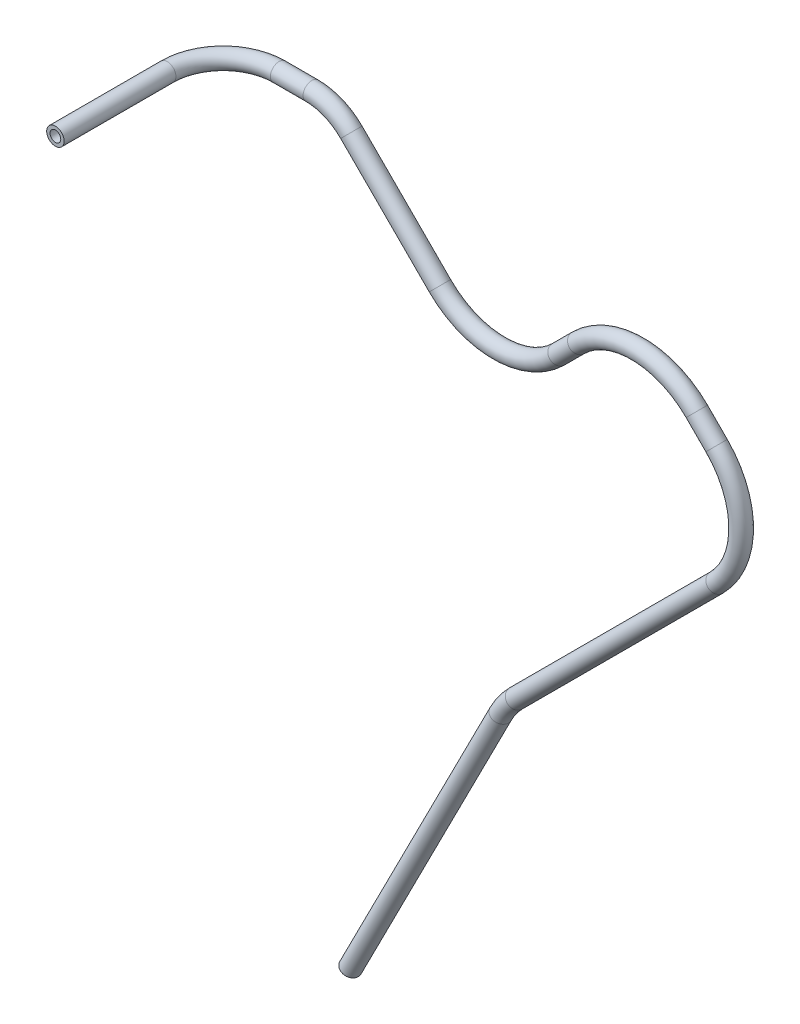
SolidWorks part; units mm, degrees
ref_plane "Front" through (0, 0, 0) normal (0, 0, 1) x (1, 0, 0)
ref_plane "Top" through (0, 0, 0) normal (0, 1, 0) x (1, 0, 0)
ref_plane "Right" through (0, 0, 0) normal (1, 0, 0) x (0, 0, -1)
sketch "Sketch1" plane through (0, 0, 0) normal (0, 0, 1) x (1, 0, 0)
  circle A0 centre (0, 0) radius 7.9375
  circle A1 centre (0, 0) radius 4.8641
  dimension "D1" = 15.875
  dimension "D2" = 9.7282
sketch3d "3DSketch2"
  line L0 (0, 0, 0) -> (0, 0, -101.6)
  line L1 (50.8, 0, -152.4) -> (80.558, 0, -152.4)
  line L2 (116.479, -14.879, -152.4) -> (196.9656, -95.3656, -152.4)
  line L3 (304.7287, -95.3656, -152.4) -> (322.5746, -77.5196, -152.4)
  line L4 (430.3377, -77.5196, -152.4) -> (448.2982, -95.4802, -152.4)
  line L5 (448.2982, -203.2432, -152.4) -> (266.0969, -385.4446, -152.4)
  line L6 (252.0803, -404.7387, -152.4) -> (115.6663, -672.5315, -152.4)
  arc A0 (50.8, 0, -152.4) -> (0, 0, -101.6) centre (50.8, 0, -101.6) ccw
  arc A1 (116.479, -14.879, -152.4) -> (80.558, 0, -152.4) centre (80.558, -50.8, -152.4) ccw
  arc A2 (430.3377, -77.5196, -152.4) -> (322.5746, -77.5196, -152.4) centre (376.4562, -131.4012, -152.4) ccw
  arc A3 (304.7287, -95.3656, -152.4) -> (196.9656, -95.3656, -152.4) centre (250.8471, -41.4841, -152.4) ccw
  arc A4 (448.2982, -203.2432, -152.4) -> (448.2982, -95.4802, -152.4) centre (394.4167, -149.3617, -152.4) ccw
  arc A5 (266.0969, -385.4446, -152.4) -> (252.0803, -404.7387, -152.4) centre (319.9784, -439.3261, -152.4) ccw
  point P6 (0, 0, -152.4)
  point P7 (50.8, 50.8, -101.6)
  point P11 (101.6, 0, -152.4)
  point P12 (80.558, -50.8, -101.6)
  point P18 (376.4562, -23.6381, -152.4)
  point P19 (376.4562, -131.4012, -76.2)
  point P22 (250.8471, -149.2471, -152.4)
  point P23 (250.8471, -41.4841, -228.6)
  point P26 (502.1797, -149.3617, -152.4)
  point P27 (394.4167, -149.3617, -76.2)
  point P31 (257.5602, -393.9813, -152.4)
  point P32 (319.9784, -439.3261, -76.2)
  dimension "D1" = 50.8
  dimension "D3" = 50.8
  dimension "D8" = 76.2
  dimension "D9" = 76.2
  dimension "D7" = 76.2
  dimension "D12" = 345.9443
  dimension "D13" = 312.6085
  dimension "D2" = 135
  dimension "D4" = 101.6
  dimension "D5" = 152.4
  dimension "D6" = 177.8
  dimension "D10" = 211.0673
  dimension "D11" = 177.638
sweep "Sweep1" add profiles "Sketch1" path "3DSketch2"
